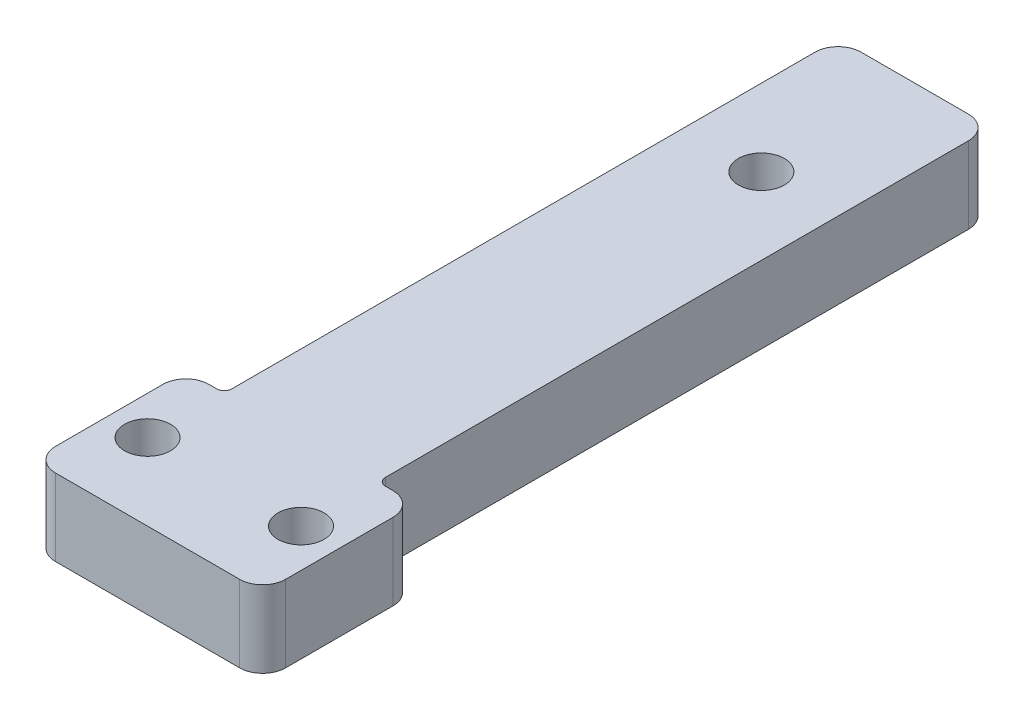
SolidWorks part; units mm, degrees
ref_plane "Alzado" through (0, 0, 0) normal (0, 0, 1) x (1, 0, 0)
ref_plane "Planta" through (0, 0, 0) normal (0, 1, 0) x (1, 0, 0)
ref_plane "Vista lateral" through (0, 0, 0) normal (1, 0, 0) x (0, 0, -1)
sketch "Croquis2" plane through (0, 0, 0) normal (0, 1, 0) x (1, 0, 0)
  line L0 (0, 3) -> (0, 17)
  line L1 (3, 20) -> (4, 20)
  line L2 (5, 21) -> (5, 97)
  line L3 (8, 100) -> (22, 100)
  line L4 (25, 97) -> (25, 21)
  line L5 (26, 20) -> (27, 20)
  line L6 (30, 17) -> (30, 3)
  line L7 (27, 0) -> (3, 0)
  arc A0 (25, 97) -> (22, 100) centre (22, 97) ccw
  arc A1 (5, 97) -> (8, 100) centre (8, 97) cw
  arc A2 (3, 0) -> (0, 3) centre (3, 3) cw
  arc A3 (27, 0) -> (30, 3) centre (27, 3) ccw
  arc A4 (0, 17) -> (3, 20) centre (3, 17) cw
  arc A5 (30, 17) -> (27, 20) centre (27, 17) ccw
  arc A6 (26, 20) -> (25, 21) centre (26, 21) cw
  arc A7 (4, 20) -> (5, 21) centre (4, 21) ccw
  point P13 (5, 100)
  point P16 (0, 0)
  point P21 (0, 20)
  point P24 (30, 20)
  point P27 (25, 20)
  point P30 (5, 20)
  dimension "D4" = 3
  dimension "D5" = 1
  dimension "D1" = 5
  dimension "D2" = 25
  dimension "D3" = 100
extrude "Saliente-Extruir1" add sketch "Croquis2" along normal blind 10
sketch "Croquis3" plane through (0, 10, 0) normal (0, 1, 0) x (1, 0, 0)
  line L5 (5, 97) -> (5, 21) construction
  line L6 (3, 0) -> (27, 0) construction
  line L11 (22, 100) -> (8, 100) construction
  circle A0 centre (5, 10) radius 3
  circle A1 centre (25, 10) radius 3
  circle A2 centre (15, 80) radius 3
  dimension "D1" = 6
  dimension "D2" = 6
  dimension "D7" = 6
  dimension "D3" = 20
  dimension "D4" = 0
  dimension "D5" = 10
  dimension "D6" = 10
  dimension "D8" = 20
  dimension "D9" = 10
extrude "Cortar-Extruir1" cut sketch "Croquis3" against normal blind 10
